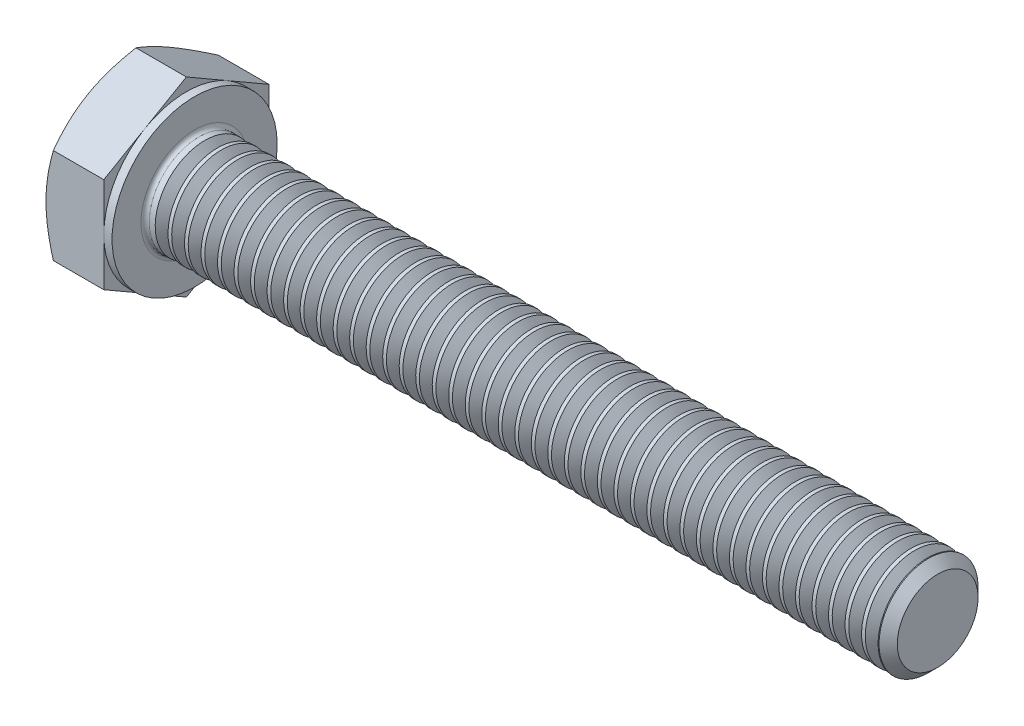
SolidWorks part; units mm, degrees
extrude "BaseHead" add sketch "Sketch1" along normal blind 4
sketch "Sketch1" plane through (0, 0, 0) normal (1, 0, 0) x (0, 0, -1)
  line L0 (5, 2.8868) -> (5, -2.8868)
  line L1 (-5, 2.8868) -> (-5, -2.8868)
  line L2 (5, -2.8868) -> (0, -5.7735)
  line L3 (0, -5.7735) -> (-5, -2.8868)
  line L4 (5, 2.8868) -> (0, 5.7735)
  line L5 (0, 5.7735) -> (-5, 2.8868)
revolve "HeadChamfer" cut sketch "Sketch3" angle 360 about L6
sketch "Sketch3" plane through (0, 0, 0) normal (0, 0, 1) x (1, 0, 0)
  line L0 (0, 5) -> (3.3333, 10.7735)
  line L1 (0, 5.7735) -> (0, 2.8868) construction
  line L2 (3.3333, 10.7735) -> (3.3333, 15.7735)
  line L3 (3.3333, 15.7735) -> (-10, 15.7735)
  line L4 (-10, 15.7735) -> (-10, 5)
  line L5 (-10, 5) -> (0, 5)
  line L6 (0, 0) -> (99.06, 0) construction
  line L7 (4, 5.7735) -> (0, 5.7735) construction
ref_plane "Plane1" through (0, 0, 0) normal (0, 0, 1) x (1, 0, 0)
ref_plane "Plane2" through (0, 0, 0) normal (0, 1, 0) x (1, 0, 0)
ref_plane "Plane3" through (0, 0, 0) normal (1, 0, 0) x (0, 0, -1)
sketch "BodySke" plane through (0, 0, 0) normal (0, 0, 1) x (1, 0, 0)
  line L0 (0, 2.8868) -> (0, -2.8868) construction
  line L1 (0, 0) -> (49, 0)
  line L2 (0, 0) -> (0, 3)
  line L3 (0, 3) -> (48.4455, 3)
  line L4 (49, 0) -> (49, 2.4455)
  line L5 (4, 5.7735) -> (4, 2.8868) construction
  line L6 (49, 2.4455) -> (48.4455, 3)
  line L7 (0, 0) -> (96.52, 0) construction
  line L8 (49, -2.4455) -> (48.4455, -3) construction
  line L9 (0, -3) -> (48.4455, -3) construction
  line L10 (5, 15.24) -> (5, -1.27) construction
  line L11 (4, 15.24) -> (4, -1.27) construction
  line L12 (4, 2.8868) -> (4, -2.8868) construction
revolve "BaseBody" add sketch "BodySke"
fillet "HeadFillet" radius 0.25 1 edges at (4, 0, -3)
sketch "Sketch4" plane through (0, 0, 0) normal (0, 0, 1) x (1, 0, 0)
  line L1 (4, 5.7735) -> (4, 2.8868) construction
  line L2 (4, 5) -> (3.5, 5)
  line L3 (4, 5) -> (4, 15.7735)
  line L4 (4, 15.7735) -> (3.5, 15.7735)
  line L5 (0, 0) -> (95.25, 0) construction
  line L6 (0, 0) -> (96.52, 0) construction
  line L7 (3.5, 5) -> (3.5, 15.7735)
  line L8 (4, 5.7735) -> (0.4466, 5.7735) construction
revolve "BearingFace" cut sketch "Sketch4" angle 360 about L5
sketch "ThdSchSke" plane through (0, 0, 0) normal (0, 0, 1) x (1, 0, 0)
  line L0 (5, -2.4455) -> (4.6117, -3)
  line L1 (5, -2.4455) -> (5.3883, -3)
  line L2 (5.3883, -3) -> (5.3883, -3.75)
  line L3 (-3.175, 0) -> (5.1513, 0) construction
  line L5 (5.3883, -3.75) -> (4.6117, -3.75)
  line L6 (4.6117, -3.75) -> (4.6117, -3)
revolve "ThreadSchematic" cut sketch "ThdSchSke" angle 360 about L3
pattern_linear "ThdSchPat" count 44 spacing 1 along (1, 0, 0) of "ThreadSchematic"
equation "\"D3@Sketch1\" = \"Width_flats@Sketch1\" / 2"
equation "\"D4@Sketch1\" = \"D3@Sketch1\""
equation "\"D5@Sketch1\" = \"D4@Sketch1\""
equation "\"Thread_minor@ThreadCosmetic\" = \"Minor_dia@BodySke\""
equation "\"D1@Sketch3\" = \"Width_flats@Sketch1\" / 2"
equation "\"D1@Sketch4\" = \"Width_flats@Sketch1\""
equation "\"Thread_length@ThreadCosmetic\" = ((sgn( (\"Length@BodySke\" - \"Advance@BodySke\" ) - \"Thread_nom@BodySke\" )-1)*( (\"Length@BodySke\" - \"Advance@BodySke\" ) - \"Thread_nom@BodySke\" ))/-2+ \"Thread_nom@BodySke\""
equation "\"Thread_minor@ThdSchSke\" = \"Minor_dia@BodySke\""
equation "\"Diameter@ThdSchSke\" = \"Diameter@BodySke\""
equation "\"Overcut@ThdSchSke\" = \"Diameter@BodySke\" * 1.25"
equation "\"Start@ThdSchSke\" = \"Head_ht@BaseHead\" + \"Length@BodySke\" - \"Thread_length@ThreadCosmetic\"  '---Non-countersunk---"
equation "\"Num_threads@ThdSchPat\" = int( \"Thread_length@ThreadCosmetic\" / \"Advance@BodySke\" + 0.999 )  + 1"
equation "\"Advance@ThdSchPat\" = \"Thread_length@ThreadCosmetic\" /  (\"Num_threads@ThdSchPat\" - 1) 'relax it"
equation "\"Num_threads@ThdSchPat\" = \"Num_threads@ThdSchPat\" - sgn( \"Num_threads@ThdSchPat\" - 1) '---chamfered tips only---"
